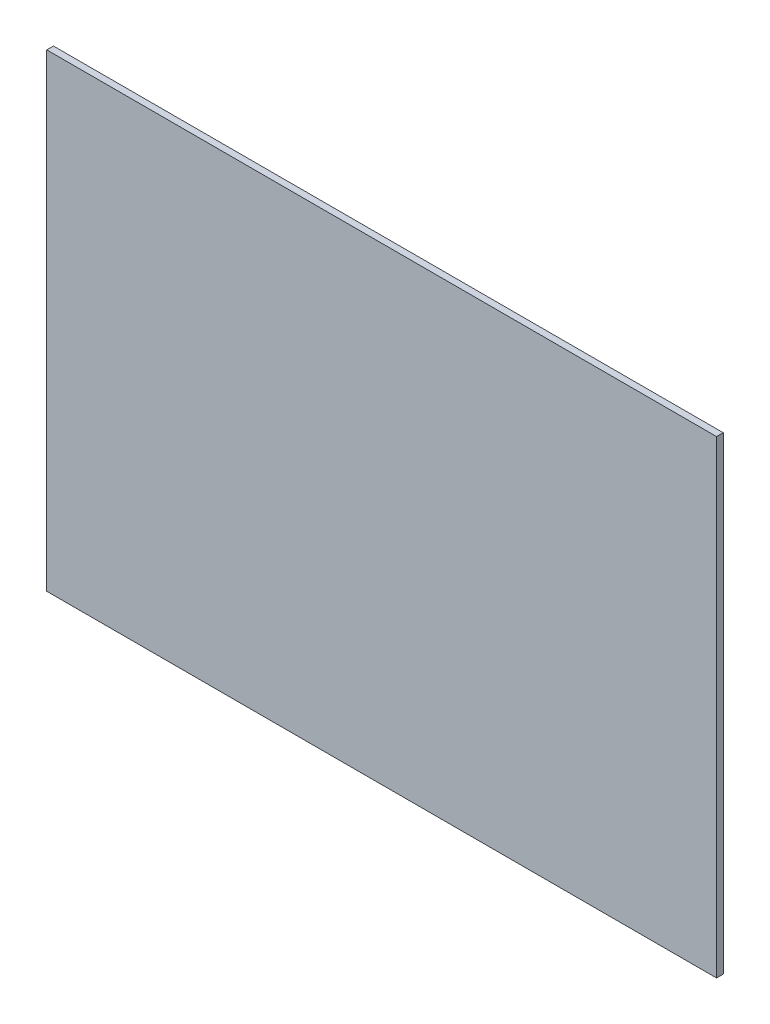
SolidWorks part; units mm, degrees
ref_plane "Спереди" through (0, 0, 0) normal (0, 0, 1) x (1, 0, 0)
ref_plane "Сверху" through (0, 0, 0) normal (0, 1, 0) x (1, 0, 0)
ref_plane "Справа" through (0, 0, 0) normal (1, 0, 0) x (0, 0, -1)
sketch "Эскиз1" plane through (0, 0, 0) normal (0, 0, 1) x (1, 0, 0)
  line L1 (0, 0) -> (-100, 0)
  line L2 (0, 0) -> (0, 70)
  line L3 (0, 70) -> (-100, 70)
  line L4 (-100, 0) -> (-100, 70)
  dimension "D1" = 70
  dimension "D2" = 100
extrude "Бобышка-Вытянуть1" add sketch "Эскиз1" along normal blind 1
